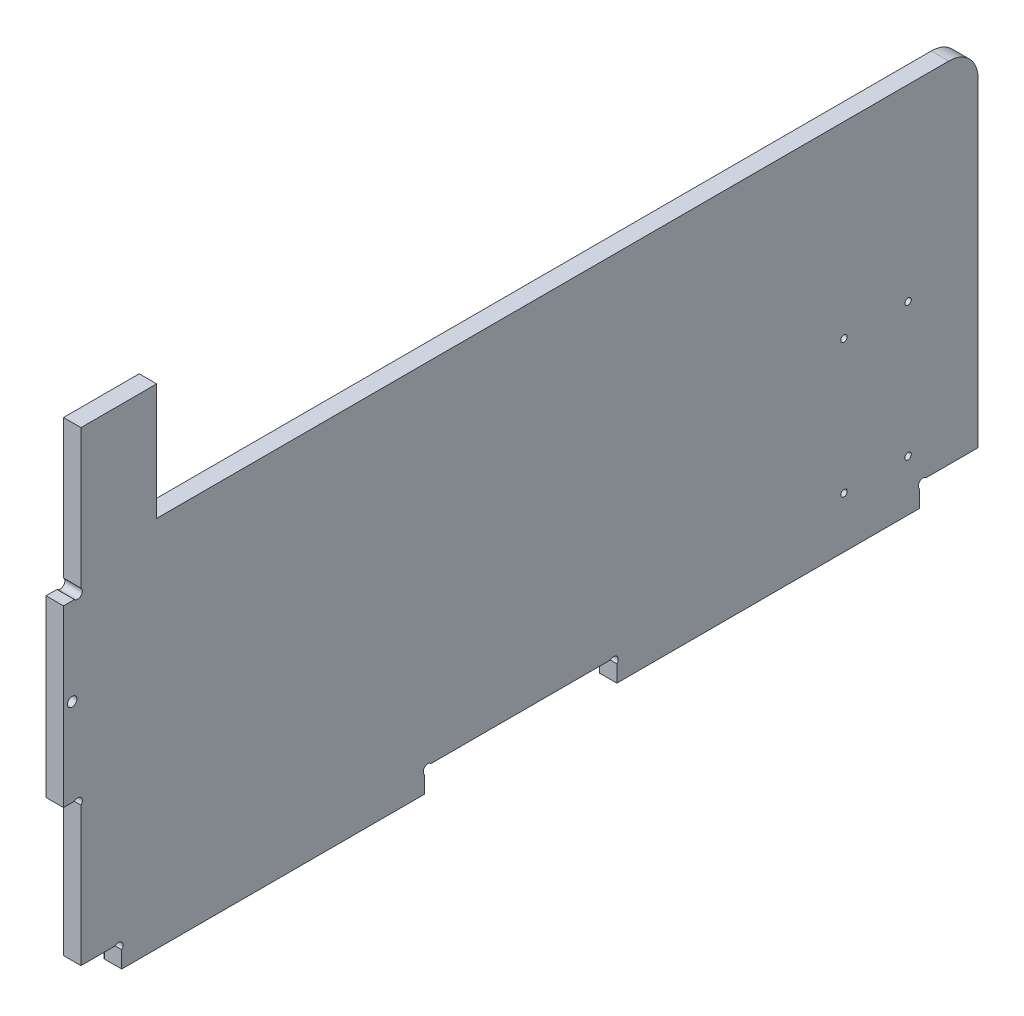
SolidWorks part; units mm, degrees
ref_plane "Plan de face" through (0, 0, 0) normal (0, 0, 1) x (1, 0, 0)
ref_plane "Plan de dessus" through (0, 0, 0) normal (0, 1, 0) x (1, 0, 0)
ref_plane "Plan de droite" through (0, 0, 0) normal (1, 0, 0) x (0, 0, -1)
sketch "Esquisse1" plane through (0, 0, 0) normal (1, 0, 0) x (0, 0, -1)
  line L0 (0, -29.3046) -> (0, 213.807) construction
  line L1 (-31.1146, 0) -> (362.1196, 0) construction
  line L2 (-31.1146, 168) -> (362.1196, 168) construction
  line L3 (314, -29.3046) -> (314, 213.807) construction
  line L4 (157, 203.6202) -> (157, 158.5445) construction
  line L5 (-7.1899, 8) -> (336.5123, 8) construction
  line L6 (6, 173.9983) -> (6, -7.2697) construction
  line L7 (294, 20.5001) -> (294, -29.3046) construction
  line L8 (190, 20.5001) -> (190, -29.3046) construction
  line L9 (242, 20.5001) -> (242, -10.0869) construction
  line L10 (-31.1146, 88) -> (22.5923, 88) construction
  line L11 (3, 106.7216) -> (3, 86.8101) construction
  line L12 (-14.4342, 143) -> (18.9701, 143) construction
  line L13 (294, 8) -> (309.4894, -7.4894) construction
  line L14 (18.9701, 118) -> (-21.7898, 118) construction
  line L15 (294, 5.7373) -> (294, 0)
  line L16 (294, 0) -> (190, 0)
  line L17 (190, 0) -> (190, 5.7373)
  line L18 (124, 0) -> (124, 5.7373)
  line L19 (20, 0) -> (124, 0)
  line L20 (20, 5.7373) -> (20, 0)
  line L21 (126.2627, 8) -> (187.7373, 8)
  line L22 (17.7373, 8) -> (6, 8)
  line L23 (6, 118) -> (-11.9258, 135.9258) construction
  line L24 (6, 120.2627) -> (6, 168)
  line L25 (3.7373, 118) -> (0, 118)
  line L26 (6, 168) -> (32, 168)
  line L27 (314, 118) -> (314, 8)
  line L28 (314, 8) -> (296.2627, 8)
  line L29 (0, 118) -> (0, 58)
  line L30 (0, 58) -> (3.7373, 58)
  line L31 (6, 55.7373) -> (6, 8)
  line L32 (336.5123, 17.5) -> (248.9848, 17.5) construction
  line L33 (336.5123, 63.5) -> (248.9848, 63.5) construction
  line L34 (290, 97.5279) -> (290, 16.6018) construction
  line L35 (268, 97.5279) -> (268, 16.6018) construction
  line L36 (248.9848, 72.5) -> (336.5123, 72.5) construction
  line L37 (32, -29.3046) -> (32, 183.8306) construction
  line L38 (336.5123, 128) -> (28.1836, 128) construction
  line L39 (32, 168) -> (32, 128)
  line L40 (32, 128) -> (304, 128)
  circle A0 centre (3, 88) radius 1.6
  arc A1 (3.7373, 118) -> (6, 120.2627) centre (4.8686, 119.1314) ccw
  arc A2 (296.2627, 8) -> (294, 5.7373) centre (295.1314, 6.8686) ccw
  arc A3 (187.7373, 8) -> (190, 5.7373) centre (188.8686, 6.8686) cw
  arc A4 (126.2627, 8) -> (124, 5.7373) centre (125.1314, 6.8686) ccw
  arc A5 (17.7373, 8) -> (20, 5.7373) centre (18.8686, 6.8686) cw
  arc A6 (3.7373, 58) -> (6, 55.7373) centre (4.8686, 56.8686) cw
  arc A7 (304, 128) -> (314, 118) centre (304, 118) cw
  circle A8 centre (268, 17.5) radius 1.1
  circle A9 centre (290, 17.5) radius 1.1
  circle A10 centre (268, 63.5) radius 1.1
  circle A11 centre (290, 63.5) radius 1.1
  point P65 (314, 168)
  point P88 (314, 128)
  dimension "D14" = 45
  dimension "D15" = 10
  dimension "D21" = 32
  dimension "D1" = 314
  dimension "D2" = 168
  dimension "D3" = 157
  dimension "D4" = 80
  dimension "D5" = 6
  dimension "D6" = 3
  dimension "D7" = 25
  dimension "D8" = 20
  dimension "D9" = 104
  dimension "D10" = 52
  dimension "D11" = 8
  dimension "D12" = 50
  dimension "D13" = 45
  dimension "D16" = 22
  dimension "D17" = 9.5
  dimension "D18" = 46
  dimension "D19" = 9
  dimension "D20" = 24
  dimension "D22" = 120
extrude "Boss.-Extru.1" add sketch "Esquisse1" along normal blind 6
